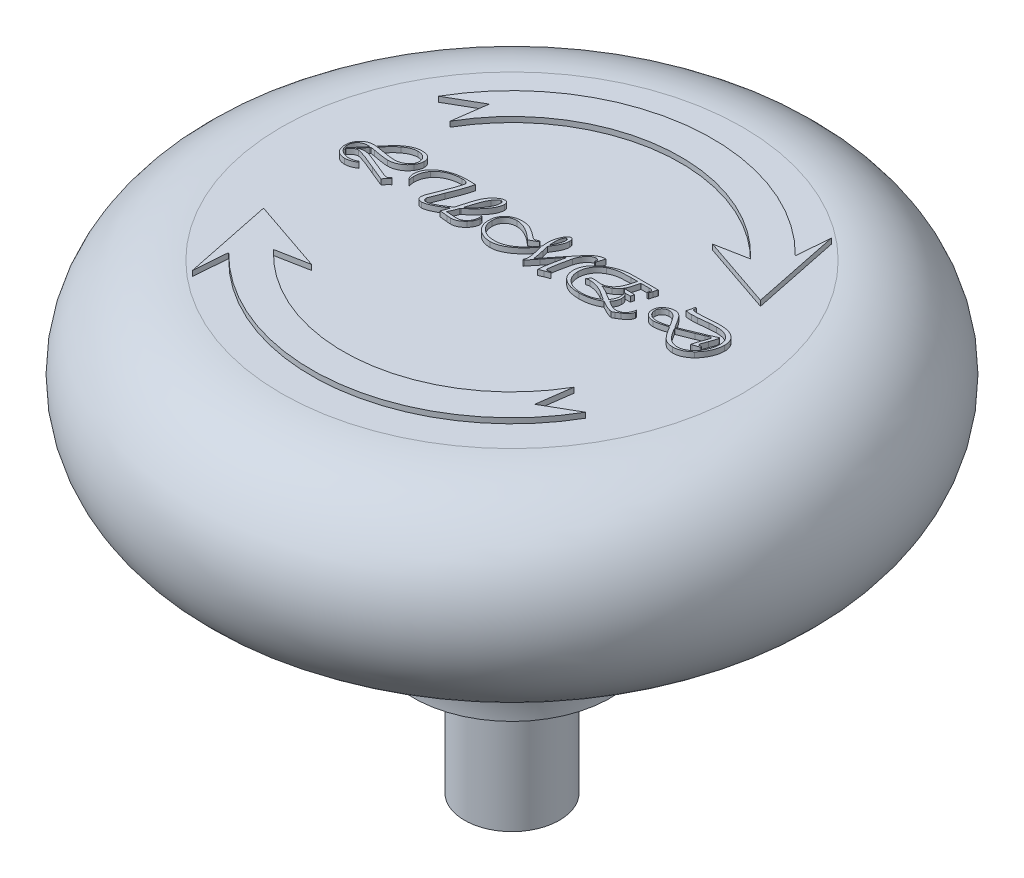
SolidWorks part; units mm, degrees
ref_plane "Front" through (0, 0, 0) normal (0, 0, 1) x (1, 0, 0)
ref_plane "Top" through (0, 0, 0) normal (0, 1, 0) x (-1, 0, 0)
ref_plane "Right" through (0, 0, 0) normal (1, 0, 0) x (0, 0, -1)
sketch "Sketch1" plane through (0, 0, 0) normal (0, 0, 1) x (1, 0, 0)
  line L0 (0, 0) -> (0, 36.2882) construction
  line L1 (0, 0) -> (0, 22.225)
  line L2 (0, 22.225) -> (11.1125, 22.225)
  line L4 (4.7625, 6.35) -> (2.286, 6.35)
  line L5 (2.286, 6.35) -> (2.286, 0)
  line L6 (2.286, 0) -> (0, 0)
  arc A0 (11.1125, 22.225) -> (11.1125, 12.7) centre (11.1125, 17.4625) cw
  arc A1 (11.1125, 12.7) -> (4.7625, 6.35) centre (11.1125, 6.35) ccw
  dimension "D5" = 6.35
  dimension "D6" = 4.7625
  dimension "D1" = 4.572
  dimension "D2" = 4.7625
  dimension "D3" = 6.35
  dimension "D4" = 15.875
revolve "Base-Revolve" add sketch "Sketch1" angle 360 about L0
ref_plane "Plane1" through (0, 22.225, 0) normal (0, 1, 0) x (1, 0, 0)
sketch "Sketch2" plane through (0, 22.225, 0) normal (0, 1, 0) x (1, 0, 0)
  line L0 (-11.1125, 0) -> (11.1125, 0) construction
  circle A0 centre (0, 0) radius 11.1125 construction
  text T0 "LUMED" font "Vivaldi" height 2.032
extrude "Boss-Extrude1" add sketch "Sketch2" along normal blind 0.254
sketch "Sketch3" plane through (0, 22.225, 0) normal (0, 1, 0) x (1, 0, 0)
  line L0 (-7.0391, 4.064) -> (-6.8101, 5.7144)
  line L1 (-6.8101, 5.7144) -> (-8.3589, 4.826)
  line L2 (7.9067, 4.064) -> (4.4082, 5.2535)
  line L3 (4.4082, 5.2535) -> (5.9405, 5.5475)
  line L4 (6.8928, 6.7565) -> (7.0205, 8.3667)
  line L5 (7.0205, 8.3667) -> (7.9067, 4.064)
  line L6 (0, 0) -> (0, 8.128) construction
  line L7 (-6.8101, 5.7144) -> (0, 0) construction
  line L8 (0, 0) -> (-8.3589, 4.826) construction
  line L9 (0, 0) -> (7.9067, 4.064) construction
  line L10 (0, 0) -> (6.8101, 5.7144) construction
  line L11 (0, 0) -> (5.7144, 6.8101) construction
  circle A0 centre (0, 0) radius 8.89 construction
  arc A1 (6.8928, 6.7565) -> (-8.3589, 4.826) centre (0, 0) ccw
  arc A2 (5.9405, 5.5475) -> (-7.0391, 4.064) centre (0, 0) ccw
  circle A3 centre (0, 0) radius 8.128 construction
  circle A4 centre (0, 0) radius 9.652 construction
  dimension "D1" = 17.78
  dimension "D4" = 10
  dimension "D5" = 50
  dimension "D6" = 10
  dimension "D7" = 1.27
  dimension "D8" = 1.27
  dimension "D2" = 0.762
  dimension "D3" = 0.762
extrude "Boss-Extrude2" add sketch "Sketch3" along normal blind 0.254
pattern_circular "CirPattern1" count 2 over 360 about axis through (0, 0, 0) along (0, 1, 0) of "Boss-Extrude2"
